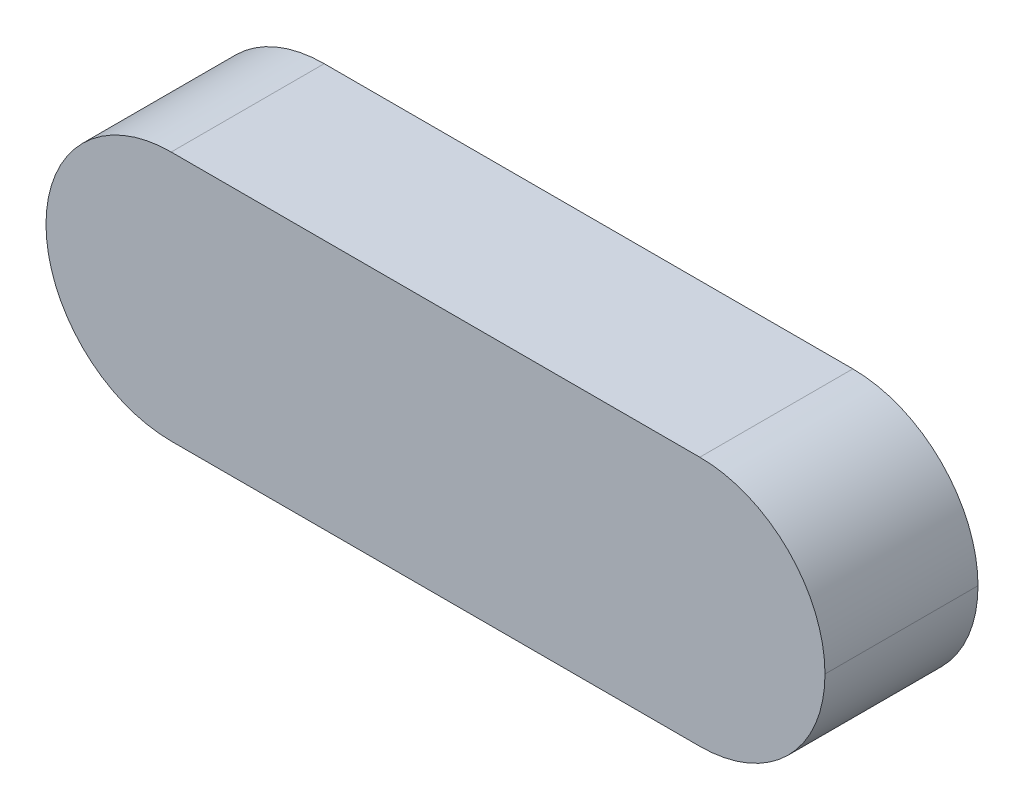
SolidWorks part; units mm, degrees
ref_plane "Спереди" through (0, 0, 0) normal (0, 0, 1) x (1, 0, 0)
ref_plane "Сверху" through (0, 0, 0) normal (0, 1, 0) x (1, 0, 0)
ref_plane "Справа" through (0, 0, 0) normal (1, 0, 0) x (0, 0, -1)
sketch "Эскиз1" plane through (0, 0, 0) normal (0, 0, 1) x (1, 0, 0)
  line L1 (28, -9) -> (-28, -9)
  line L2 (28, -9) -> (28, 9)
  line L3 (28, 9) -> (-28, 9)
  line L4 (-28, -9) -> (-28, 9)
  line L5 (28, -9) -> (-28, 9) construction
  line L6 (28, 9) -> (-28, -9) construction
  point P0 (0, 0)
  dimension "D1" = 18
  dimension "D2" = 56
extrude "Бобышка-Вытянуть1" add sketch "Эскиз1" along normal blind 11 contours L3 L4 L1 L2
fillet "Скругление1" radius 9 4 edges at (-28, -9, 5.5) (-28, 9, 5.5) (28, -9, 5.5) (28, 9, 5.5)
